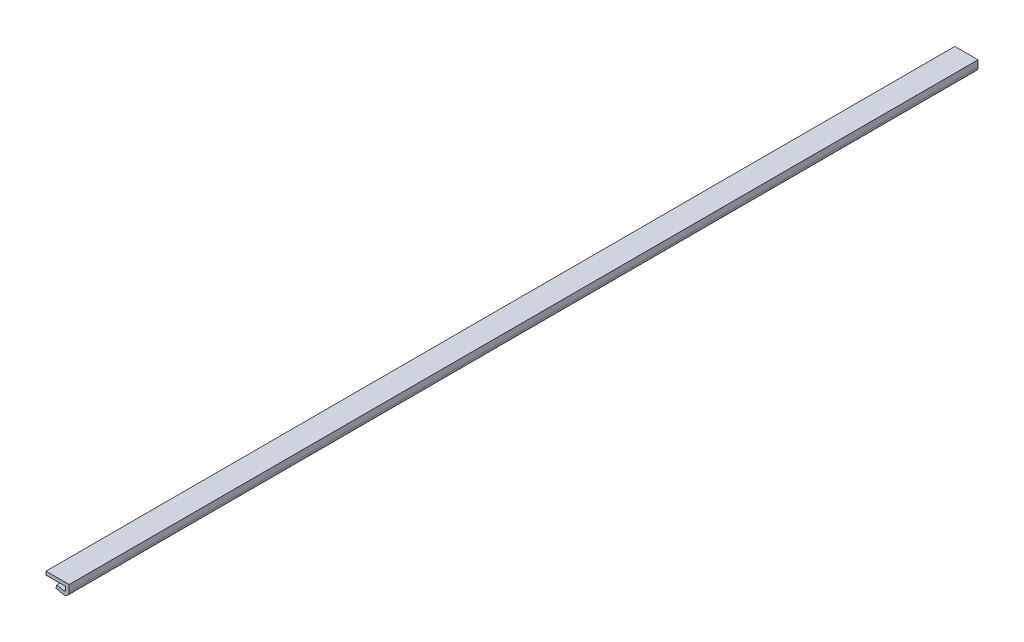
SolidWorks part; units mm, degrees
ref_plane "Plan de face" through (0, 0, 0) normal (0, 0, 1) x (1, 0, 0)
ref_plane "Plan de dessus" through (0, 0, 0) normal (0, 1, 0) x (1, 0, 0)
ref_plane "Plan de droite" through (0, 0, 0) normal (1, 0, 0) x (0, 0, -1)
sketch "Esquisse1" plane through (0, 0, 0) normal (0, 0, 1) x (1, 0, 0)
  line L0 (0, 0) -> (20, 0)
  line L1 (0, 0) -> (0, -3)
  line L2 (0, -3) -> (17, -3)
  line L3 (20, 0) -> (20, -5.5)
  line L4 (14.4114, -9.8663) -> (8.5739, -8.4109)
  line L5 (8.5739, -8.4109) -> (9.2997, -5.5)
  line L6 (9.2997, -5.5) -> (15.1371, -6.9554)
  line L7 (17, -3) -> (17, -5.5)
  arc A0 (20, -5.5) -> (14.4114, -9.8663) centre (15.5, -5.5) cw
  arc A1 (15.1371, -6.9554) -> (17, -5.5) centre (15.5, -5.5) ccw
  dimension "D5" = 1.5
  dimension "D1" = 20
  dimension "D2" = 3
  dimension "D3" = 17
  dimension "D4" = 5.5
  dimension "D6" = 76
  dimension "D7" = 2.5
extrude "Extrusion1" add sketch "Esquisse1" along normal blind 785
sketch "Esquisse2" plane through (0, 0, 785) normal (0, 0, 1) x (1, 0, 0)
  line L0 (0, 0) -> (20, 0)
  line L1 (20, 0) -> (20, -5.5)
  line L2 (14.4114, -9.8663) -> (8.5739, -8.4109)
  line L3 (8.5739, -8.4109) -> (9.2997, -5.5)
  line L4 (9.2997, -5.5) -> (15.1371, -6.9554)
  line L5 (17, -5.5) -> (17, -3)
  line L6 (17, -3) -> (0, -3)
  line L7 (0, -3) -> (0, 0)
  line L8 (-2.5369, -69) -> (22.7877, -69) construction
  arc A0 (20, -5.5) -> (14.4114, -9.8663) centre (15.5, -5.5) cw
  arc A1 (15.1371, -6.9554) -> (17, -5.5) centre (15.5, -5.5) ccw
  dimension "D1" = 66
sketch "Esquisse3" [suppressed] plane through (0, 0, 0) normal (0, 0, -1) x (-1, 0, 0)
  line L0 (0, 0) -> (-20, 0)
  line L1 (-20, 0) -> (-20, -5.5)
  line L2 (-14.4114, -9.8663) -> (-8.5739, -8.4109)
  line L3 (-8.5739, -8.4109) -> (-9.2997, -5.5)
  line L4 (-9.2997, -5.5) -> (-15.1371, -6.9554)
  line L5 (-17, -5.5) -> (-17, -3)
  line L6 (-17, -3) -> (0, -3)
  line L7 (0, -3) -> (0, 0)
  line L8 (-30.2357, -69) -> (10.1051, -69) construction
  arc A0 (-20, -5.5) -> (-14.4114, -9.8663) centre (-15.5, -5.5) ccw
  arc A1 (-15.1371, -6.9554) -> (-17, -5.5) centre (-15.5, -5.5) cw
  dimension "D1" = 66
